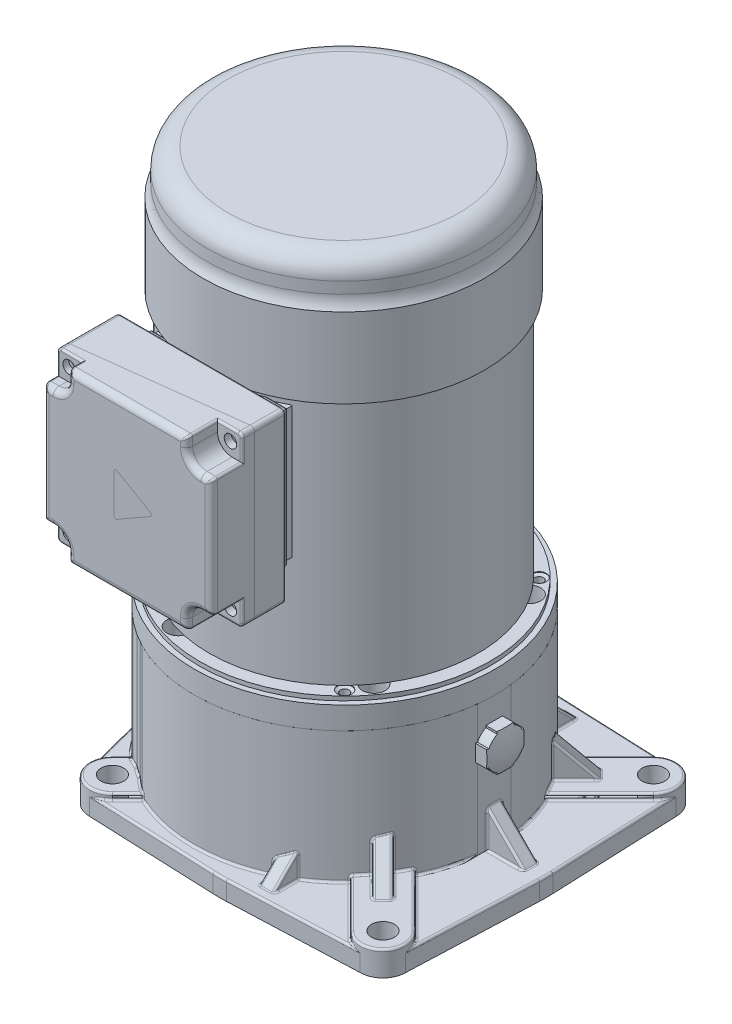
SolidWorks part; units mm, degrees
ref_plane "前视基准面" through (0, 0, 0) normal (0, 0, 1) x (1, 0, 0)
ref_plane "上视基准面" through (0, 0, 0) normal (0, 1, 0) x (1, 0, 0)
ref_plane "右视基准面" through (0, 0, 0) normal (1, 0, 0) x (0, 0, -1)
imported_body "接线盒座-1-surface1"
imported_body "接线盒座-1-surface2"
imported_body "接线盒座-1-surface3"
imported_body "接线盒座-1-surface4"
imported_body "接线盒座-1-surface5"
imported_body "接线盒座-1-surface6"
imported_body "接线盒座-1-surface7"
imported_body "接线盒盖-1-surface1"
imported_body "接线盒盖-1-surface2"
imported_body "接线盒盖-1-surface3"
imported_body "接线盒盖-1-surface4"
imported_body "立式箱体装配.SLDPRT-1/15.11.08 22箱盖B-1-surface1"
imported_body "立式箱体装配.SLDPRT-1/15.05.20 22立式B-1-surface1"
imported_body "立式箱体装配.SLDPRT-1/3轴22-1-surface1"
imported_body "立式箱体装配.SLDPRT-1/3轴22-1-surface2"
imported_body "立式箱体装配.SLDPRT-1/GB／T13871．1-2007唇形密封圈B型B1525X40X7-1-surface1"
imported_body "立式箱体装配.SLDPRT-1/透气塞-1-surface1"
imported_body "立式箱体装配.SLDPRT-1/7X32-1-surface1"
sketch "草图1" plane through (0, -136.6427, 0) normal (0, 1, 0) x (1, 0, 0)
  circle A0 centre (262.1378, 88.1377) radius 65
  circle A1 centre (281.1275, 88.1377) radius 18.9896 construction
extrude "凸台-拉伸1" add sketch "草图1" along normal blind 120
sketch "草图2" plane through (0, -16.6427, 0) normal (0, 1, 0) x (1, 0, 0)
  circle A0 centre (262.1378, 88.1377) radius 68
extrude "凸台-拉伸2" add sketch "草图2" along normal blind 38.5
sketch "草图3" plane through (0, 21.8573, 0) normal (0, 1, 0) x (1, 0, 0)
  circle A0 centre (262.1378, 88.1377) radius 66
extrude "凸台-拉伸3" add sketch "草图3" along normal blind 21.5
fillet "圆角1" radius 10 2 edges at (262.1378, 43.3573, -22.1377) (262.1378, 21.8573, -22.1377)
